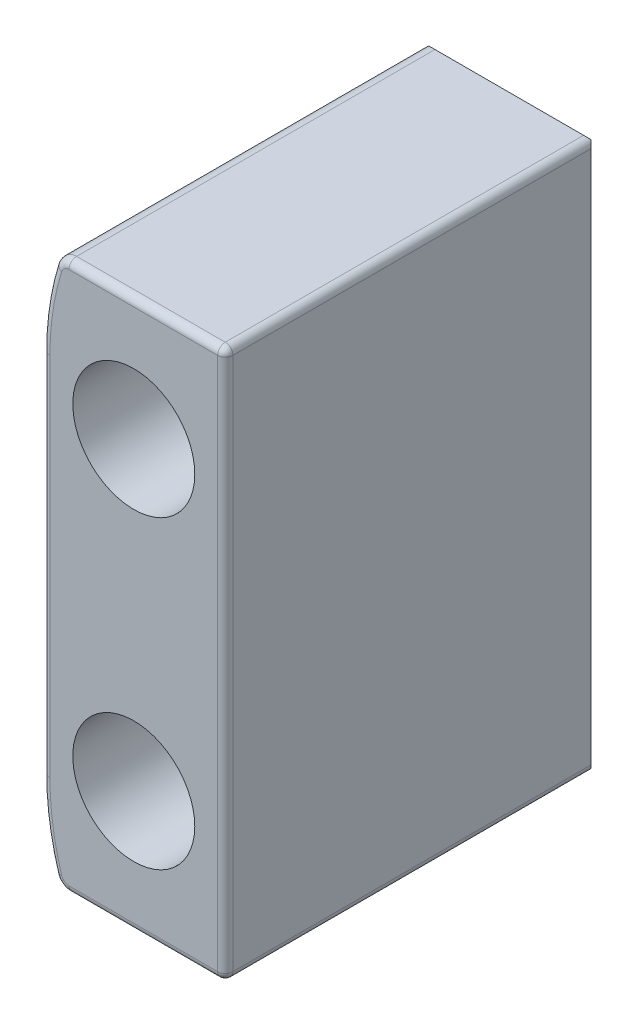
SolidWorks part; units mm, degrees
ref_plane "Front Plane" through (0, 0, 0) normal (0, 0, 1) x (1, 0, 0)
ref_plane "Top Plane" through (0, 0, 0) normal (0, 1, 0) x (1, 0, 0)
ref_plane "Right Plane" through (0, 0, 0) normal (1, 0, 0) x (0, 0, -1)
sketch "Sketch1" plane through (0, 0, 0) normal (0, 0, 1) x (1, 0, 0)
  line L1 (-12, 18) -> (0, 18)
  line L2 (-12, 18) -> (-12, -18)
  line L3 (-12, -18) -> (0, -18)
  line L4 (0, 18) -> (0, -18)
  dimension "D1" = 12
  dimension "D2" = 36
extrude "Boss-Extrude1" add sketch "Sketch1" against normal blind 25
sketch "Sketch2" plane through (0, 0, 0) normal (0, 0, 1) x (1, 0, 0)
  line L0 (0, 18) -> (-12, 18) construction
  line L1 (-12, 18) -> (-12, -18) construction
  line L3 (0, 0) -> (-12.1658, 0) construction
  line L4 (55, 0) -> (-55, 0) construction
  line L5 (-12, -18) -> (-12, -12)
  line L6 (-12, -18) -> (-10.9706, -18)
  line L8 (-12, -18) -> (0, -18) construction
  line L9 (-10.9706, 18) -> (-12, 18)
  line L10 (-12, 18) -> (-12, 12)
  arc A0 (-10.9706, 18) -> (-12, 12) centre (6, 12) ccw
  arc A1 (-12, -12) -> (-10.9706, -18) centre (6, -12) ccw
  dimension "D2" = 18
  dimension "D3" = 36
  dimension "D1" = 6
extrude "Cut-Extrude1" cut sketch "Sketch2" against normal through all
chamfer "Chamfer1" distance 1 angle 45 6 edges at (0, 0, -25) (-5.4853, 18, -25) (-11.7408, 15.0438, -25) (-12, 0, -25) (-11.7408, -15.0438, -25) (-5.4853, -18, -25)
fillet "Fillet1" radius 0.5 8 edges at (0, 18, -12) (0, -18, -12) (-12, 0, 0) (-11.7408, 15.0438, 0) (-5.4853, 18, 0) (0, 0, 0) (-5.4853, -18, 0) (-11.7408, -15.0438, 0)
fillet "Fillet2" radius 1 4 edges at (-10.9706, 18, -12.25) (-10.9706, -18, -12.25) (-10.8495, -17.8294, -0.1238) (-10.8495, 17.8294, -0.1238)
hole_wizard "CBORE for M4 SHCS1" positions "Sketch5" profile "Sketch6" counterbore size "M4" standard "ANSI Metric"
sketch "Sketch5" plane through (0, 0, 0) normal (0, 0, -1) x (-1, 0, 0)
  point P0 (6, 10)
  point P2 (6, -10)
  dimension "D1" = 10
  dimension "D2" = 20
  dimension "D3" = 6
sketch "Sketch6" plane through (-6, 10, 0) normal (1, 0, 0) x (0, -1, 0)
  line L0 (0, 0) -> (0, 25)
  line L1 (0, 25) -> (2.5, 25)
  line L3 (2.5, 25) -> (2.5, 6)
  line L4 (2.5, 6) -> (4, 6)
  line L5 (4, 6) -> (4, 0)
  line L7 (4, 0) -> (0, 0)
  line L11 (0, -6.35) -> (0, 107.95) construction
  dimension "Thru Hole Dia." = 5
  dimension "Thru Hole Depth" = 25
  dimension "C'Bore Dia." = 8
  dimension "C'Bore Depth" = 6
